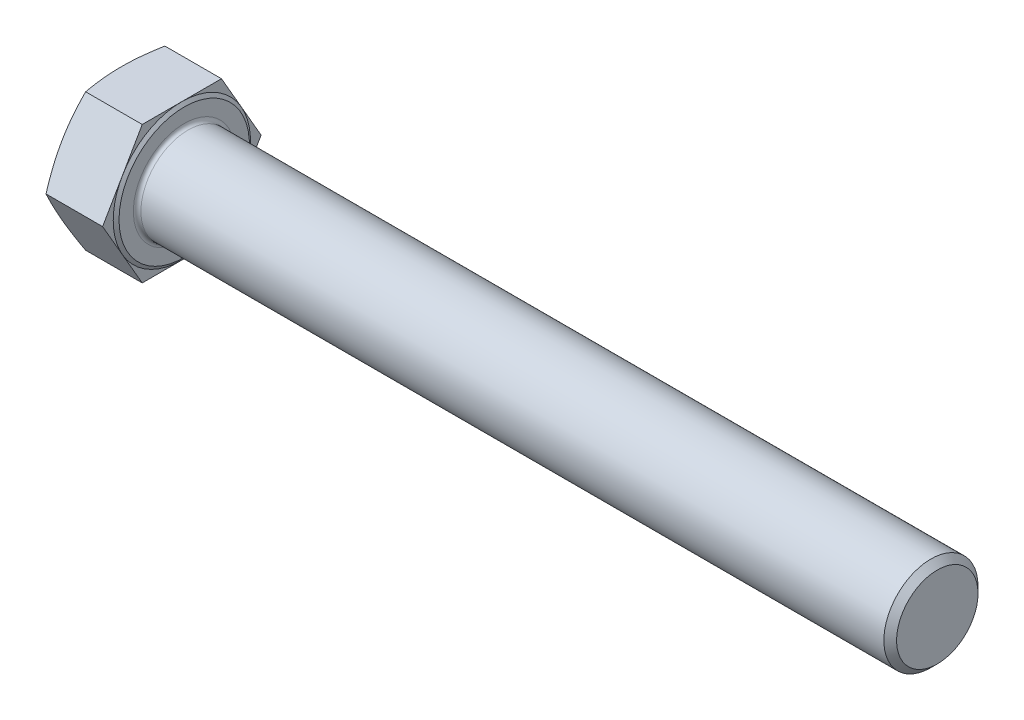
SolidWorks part; units mm, degrees
ref_plane "Front" through (0, 0, 0) normal (0, 0, 1) x (1, 0, 0)
ref_plane "Top" through (0, 0, 0) normal (0, 1, 0) x (1, 0, 0)
ref_plane "Right" through (0, 0, 0) normal (1, 0, 0) x (0, 0, -1)
sketch "Sketch-BaseHead" plane through (0, 0, 0) normal (1, 0, 0) x (0, 0, -1)
  line L1 (16.8355, 0) -> (8.4178, 14.58)
  line L2 (8.4178, 14.58) -> (-8.4178, 14.58)
  line L3 (-8.4178, 14.58) -> (-16.8355, 0)
  line L4 (-16.8355, 0) -> (-8.4178, -14.58)
  line L5 (-8.4178, -14.58) -> (8.4178, -14.58)
  line L6 (8.4178, -14.58) -> (16.8355, 0)
  circle A0 centre (0, 0) radius 14.58 construction
  dimension "s" = 29.16
extrude "BaseHead" add sketch "Sketch-BaseHead" along normal blind 12.85
sketch "Sketch4" plane through (-0.2646, 0, 5.9169) normal (0, 1, 0) x (0, 0, -1)
  line L0 (5.9169, 3.7369) -> (5.9169, -10.4477) construction
  line L2 (22.7524, -0.2646) -> (20.4969, -0.2646)
  line L4 (20.4969, -0.2646) -> (22.7524, -1.0856)
  line L6 (22.7524, -1.0856) -> (22.7524, -0.2646)
  dimension "D1" = 20
  dimension "D2" = 29.16
revolve "HeadChamfer" cut sketch "Sketch4" angle 360 about L0
sketch "Sketch1" plane through (0, 0, 0) normal (0, 0, 1) x (1, 0, 0)
  line L0 (12.85, 0) -> (13.35, 0)
  line L1 (13.35, 0) -> (13.35, -13.85)
  line L2 (13.35, -13.85) -> (12.85, -14.58)
  line L3 (12.85, -14.58) -> (12.85, 0) construction
  line L4 (0, 0) -> (7.5821, 0) construction
  line L5 (-4.0016, 0) -> (10.1831, 0) construction
  line L6 (12.85, -14.58) -> (0.8209, -14.58) construction
  line L7 (12.85, 0) -> (12.85, -14.58)
  dimension "D1" = 14.58
  dimension "c" = 0.5
  dimension "D2" = 13.85
revolve "Revolve1" add sketch "Sketch1" angle 360 about axis through (-4.0016, 0, 0) along (1, 0, 0)
ref_plane "Plane2" through (121.35, 0, 0) normal (1, 0, 0) x (0, 0, -1)
sketch "Sketch3" plane through (13.35, 0, 0) normal (1, 0, 0) x (0, 0, -1)
  circle A0 centre (0, 0) radius 10
  dimension "d" = 20
extrude "BaseBody" add sketch "Sketch3" along normal blind 160
fillet "HeadFillet" radius 0.8 1 edges at (13.35, 0, -10)
chamfer "Chamfer1" distance 1.353 angle 45 1 edges at (173.35, 0, -10)
equation "\"D1@Sketch1\" = \"s@Sketch-BaseHead\"/ 2"
equation "\"D2@Sketch4\" = \"s@Sketch-BaseHead\""
equation "\"D1@Chamfer1\" =  ( \"d@Sketch3\" - \"D2@ThreadCosmetic1\" ) / 2 "
equation "\"b@ThreadCosmetic1\" = \"l@BaseBody\" - \"lg@Plane2\""
